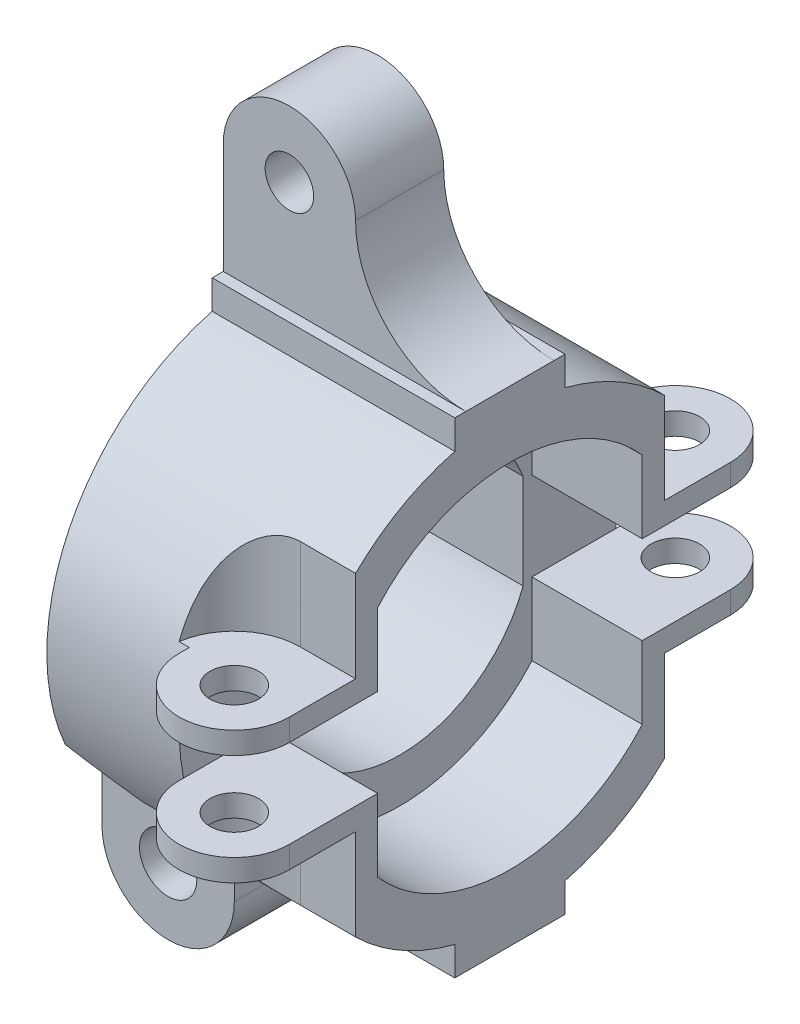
SolidWorks part; units mm, degrees
ref_plane "Front Plane" through (0, 0, 0) normal (0, 0, 1) x (1, 0, 0)
ref_plane "Top Plane" through (0, 0, 0) normal (0, 1, 0) x (1, 0, 0)
ref_plane "Right Plane" through (0, 0, 0) normal (1, 0, 0) x (0, 0, -1)
sketch "Sketch2" plane through (0, 0, 0) normal (0, 0, 1) x (1, 0, 0)
  line L0 (0, 0) -> (0, 30.48) construction
  line L1 (-3.81, 0) -> (-3.81, 30.48)
  line L2 (3.81, 0) -> (3.81, 30.48)
  arc A0 (-3.81, 0) -> (3.81, 0) centre (0, 0) ccw
  arc A1 (3.81, 30.48) -> (-3.81, 30.48) centre (0, 30.48) ccw
  point P3 (0, 15.24)
  dimension "D2" = 3.81
  dimension "D1" = 30.48
extrude "Boss-Extrude1" add sketch "Sketch2" along normal mid plane 19.05
sketch "Sketch3" plane through (3.81, 0, 0) normal (1, 0, 0) x (0, 0, -1)
  line L0 (0, -9.5142) -> (0, 39.3808) construction
  line L1 (-2.54, 38.2417) -> (-2.54, 22.86)
  line L2 (-2.54, 22.86) -> (-9.525, 15.24)
  line L3 (-9.525, 0) -> (-9.525, 30.48) construction
  line L4 (-9.525, 15.24) -> (-12.7872, 15.24)
  line L5 (-12.7872, 15.24) -> (-12.7872, 38.2417)
  line L6 (-12.7872, 38.2417) -> (-2.54, 38.2417)
  line L7 (-9.525, 0) -> (9.525, 0) construction
  line L8 (12.7872, 15.24) -> (12.7872, 38.2417)
  line L9 (9.525, 15.24) -> (12.7872, 15.24)
  line L10 (2.54, 22.86) -> (9.525, 15.24)
  line L11 (2.54, 38.2417) -> (2.54, 22.86)
  line L12 (12.7872, 38.2417) -> (2.54, 38.2417)
  dimension "D1" = 2.54
  dimension "D2" = 15.24
  dimension "D3" = 7.62
extrude "Cut-Extrude1" cut sketch "Sketch3" against normal through all
sketch "Sketch4" plane through (3.81, 0, 0) normal (1, 0, 0) x (0, 0, -1)
  line L0 (-9.525, 0) -> (9.525, 0) construction
  circle A4 centre (0, 10.16) radius 9.525
  circle A5 centre (0, 10.16) radius 12.7
  dimension "D1" = 25.4
  dimension "D6" = 19.05
  dimension "D2" = 10.16
sketch "Sketch5" plane through (0, 0, 9.525) normal (0, 0, 1) x (1, 0, 0)
  circle A0 centre (0, 30.48) radius 1.397
  circle A1 centre (0, 0) radius 1.651
  dimension "D1" = 3.302
  dimension "D2" = 2.794
extrude "Boss-Extrude4" add sketch "Sketch4" against normal up to surface (7.62 mm away)
sketch "Sketch6" plane through (0, 0, 9.525) normal (0, 0, 1) x (1, 0, 0)
  line L1 (-3.81, 22.5399) -> (-3.81, 1.7597) construction
  line L2 (-3.81, 3.81) -> (-3.81, 0)
  line L3 (0, 3.81) -> (3.81, 3.81)
  line L4 (3.81, 1.7597) -> (3.81, 22.5399) construction
  line L5 (3.81, 3.81) -> (3.81, 0)
  line L6 (0, 3.81) -> (-3.81, 5.08)
  line L7 (-3.81, 5.08) -> (-3.81, 3.81)
  arc A0 (-3.81, 0) -> (3.81, 0) centre (0, 0) ccw
  dimension "D1" = 1.27
extrude "Cut-Extrude10" cut sketch "Sketch6" along normal through all
mirror "Mirror3" about plane through (0, 0, 0) normal (0, 0, 1) of "Cut-Extrude10"
sketch "Sketch7" plane through (3.81, 0, 0) normal (1, 0, 0) x (0, 0, -1)
  line L0 (-14.5189, 10.16) -> (16.9557, 10.16) construction
  line L1 (-12.4434, 7.62) -> (-9.8374, 7.62)
  line L2 (9.8374, 7.62) -> (12.4434, 7.62)
  line L3 (9.8374, 12.7) -> (12.4434, 12.7)
  line L4 (-12.4434, 12.7) -> (-9.8374, 12.7)
  arc A0 (-12.4434, 7.62) -> (12.4434, 7.62) centre (0, 10.16) ccw
  arc A1 (-9.8374, 7.62) -> (9.8374, 7.62) centre (0, 10.16) ccw
  arc A2 (-12.4434, 12.7) -> (12.4434, 12.7) centre (0, 10.16) cw
  arc A3 (-9.8374, 12.7) -> (9.8374, 12.7) centre (0, 10.16) cw
  dimension "D2" = 2.54
  dimension "D1" = 2.54
extrude "Boss-Extrude5" add sketch "Sketch7" along normal blind 6.35
sketch "Sketch8" plane through (3.81, 0, 0) normal (1, 0, 0) x (0, 0, -1)
  line L0 (-7.112, 12.8957) -> (-7.112, 7.4243)
  line L1 (0, 25.2134) -> (0, -5.5286) construction
  line L2 (7.112, 12.8957) -> (7.112, 7.4243)
  arc A2 (-7.112, 7.4243) -> (7.112, 7.4243) centre (0, 10.16) ccw
  arc A3 (7.112, 12.8957) -> (-7.112, 12.8957) centre (0, 10.16) ccw
  dimension "D3" = 15.24
  dimension "D1" = 7.112
extrude "Cut-Extrude11" cut sketch "Sketch8" against normal through all
sketch "Sketch9" plane through (3.81, 0, 0) normal (1, 0, 0) x (0, 0, -1)
  line L0 (-12.4434, 12.7) -> (-7.62, 12.7)
  line L3 (-18.546, 10.16) -> (18.546, 10.16) construction
  line L4 (0, 30.337) -> (0, -10.017) construction
  line L15 (-7.62, 12.7) -> (-7.62, 20.32)
  line L16 (-7.62, 7.62) -> (-7.62, 0)
  line L17 (-12.4434, 7.62) -> (-7.62, 7.62)
  line L18 (7.62, 12.7) -> (7.62, 20.32)
  line L19 (12.4434, 12.7) -> (7.62, 12.7)
  line L20 (12.4434, 7.62) -> (7.62, 7.62)
  line L21 (7.62, 7.62) -> (7.62, 0)
  arc A1 (-7.62, 20.32) -> (-12.4434, 12.7) centre (0, 10.16) ccw
  arc A9 (-7.62, 0) -> (-12.4434, 7.62) centre (0, 10.16) cw
  arc A10 (7.62, 20.32) -> (12.4434, 12.7) centre (0, 10.16) cw
  arc A11 (7.62, 0) -> (12.4434, 7.62) centre (0, 10.16) ccw
  point P13 (0, 10.16)
  point P18 (0, 10.16)
  dimension "D1" = 7.62
extrude "Boss-Extrude6" add sketch "Sketch9" along normal up to surface (6.35 mm away)
sketch "Sketch10" plane through (0, 0, 0) normal (1, 0, 0) x (0, 0, -1)
  line L0 (-9.525, -3.81) -> (9.525, -3.81) construction
  line L1 (-3.175, -3.81) -> (3.175, -3.81)
  line L2 (-3.175, -3.81) -> (-3.175, 0)
  line L3 (-3.175, 0) -> (3.175, 0)
  line L4 (3.175, -3.81) -> (3.175, 0)
  line L7 (-3.175, 20.32) -> (3.175, 20.32)
  line L8 (-3.175, 20.32) -> (-3.175, 24.13)
  line L9 (-3.175, 24.13) -> (3.175, 24.13)
  line L10 (3.175, 20.32) -> (3.175, 24.13)
  dimension "D1" = 6.35
  dimension "D2" = 3.175
  dimension "D3" = 3.81
  dimension "D4" = 3.81
extrude "Boss-Extrude7" add sketch "Sketch10" against normal up to surface and the other way up to surface
extrude "Cut-Extrude12" cut sketch "Sketch5" against normal through all
sketch "Sketch12" plane through (0, 12.7, 0) normal (0, -1, 0) x (1, 0, 0)
  line L0 (6.985, -12.4434) -> (6.985, -8.9181) construction
  line L1 (10.16, -12.4434) -> (3.81, -12.4434) construction
  line L2 (10.16, 12.4434) -> (3.81, 12.4434) construction
  line L3 (6.985, 12.7) -> (6.985, 9.1306) construction
  line L4 (10.16, 12.7) -> (10.16, 9.1306)
  line L5 (3.81, 12.7) -> (3.81, 9.1306)
  line L6 (3.81, 9.1306) -> (10.16, 9.1306)
  line L7 (3.81, -8.9181) -> (10.16, -8.9181)
  line L8 (3.81, -8.9181) -> (3.81, -12.7)
  line L9 (6.985, 9.1306) -> (6.985, 12.4434) construction
  line L10 (10.16, -8.9181) -> (10.16, -12.7)
  line L11 (6.985, -8.9181) -> (6.985, -12.7) construction
  arc A0 (10.16, 12.7) -> (3.81, 12.7) centre (6.985, 12.7) ccw
  arc A1 (3.81, -12.7) -> (10.16, -12.7) centre (6.985, -12.7) ccw
  point P8 (6.985, 0)
  dimension "D2" = 3.175
  dimension "D1" = 25.4
extrude "Boss-Extrude8" add sketch "Sketch12" against normal blind 1.27
sketch "Sketch13" plane through (0, 7.62, 0) normal (0, 1, 0) x (1, 0, 0)
  line L0 (6.985, -12.7) -> (6.985, -10.253) construction
  line L1 (3.81, -12.7) -> (3.81, -10.253)
  line L2 (10.16, -12.7) -> (10.16, -10.253)
  line L3 (10.16, 10.1958) -> (3.81, 10.1958)
  line L4 (10.16, -10.253) -> (3.81, -10.253)
  line L5 (10.16, 10.1958) -> (10.16, 12.7)
  line L6 (6.985, 10.1958) -> (6.985, 12.7) construction
  line L7 (3.81, 10.1958) -> (3.81, 12.7)
  arc A0 (3.81, -12.7) -> (10.16, -12.7) centre (6.985, -12.7) ccw
  arc A1 (10.16, 12.7) -> (3.81, 12.7) centre (6.985, 12.7) ccw
  point P4 (6.985, 0)
  dimension "D1" = 3.175
extrude "Boss-Extrude9" add sketch "Sketch13" against normal blind 1.27
fillet "Fillet1" radius 6.35 1 edges at (3.81, 24.13, 0)
sketch "Sketch14" plane through (0, 6.35, 0) normal (0, -1, 0) x (1, 0, 0)
  line L0 (6.985, 8.89) -> (10.795, 8.89)
  line L1 (10.795, 8.89) -> (10.795, 12.7)
  line L2 (6.985, -8.89) -> (10.795, -8.89)
  line L3 (10.795, -8.89) -> (10.795, -12.7)
  arc A2 (10.795, 12.7) -> (6.985, 8.89) centre (6.985, 12.7) ccw
  arc A3 (6.985, -8.89) -> (10.795, -12.7) centre (6.985, -12.7) ccw
  dimension "D1" = 7.62
  dimension "D2" = 7.62
extrude "Cut-Extrude13" cut sketch "Sketch14" along normal through all
sketch "Sketch15" plane through (0, 13.97, 0) normal (0, 1, 0) x (1, 0, 0)
  line L0 (6.985, -8.89) -> (11.2068, -8.89)
  line L1 (11.2068, -8.89) -> (10.795, -12.7)
  line L2 (6.985, 8.89) -> (10.795, 8.89)
  line L3 (10.795, 8.89) -> (10.795, 12.7)
  arc A2 (6.985, -8.89) -> (10.795, -12.7) centre (6.985, -12.7) ccw
  arc A3 (10.795, 12.7) -> (6.985, 8.89) centre (6.985, 12.7) ccw
  dimension "D1" = 7.62
extrude "Cut-Extrude14" cut sketch "Sketch15" along normal through all
sketch "Sketch16" plane through (0, 13.97, 0) normal (0, 1, 0) x (1, 0, 0)
  circle A0 centre (6.985, -12.7) radius 1.397
  circle A1 centre (6.985, 12.7) radius 1.397
  dimension "D1" = 2.794
extrude "Cut-Extrude15" cut sketch "Sketch16" against normal through all
